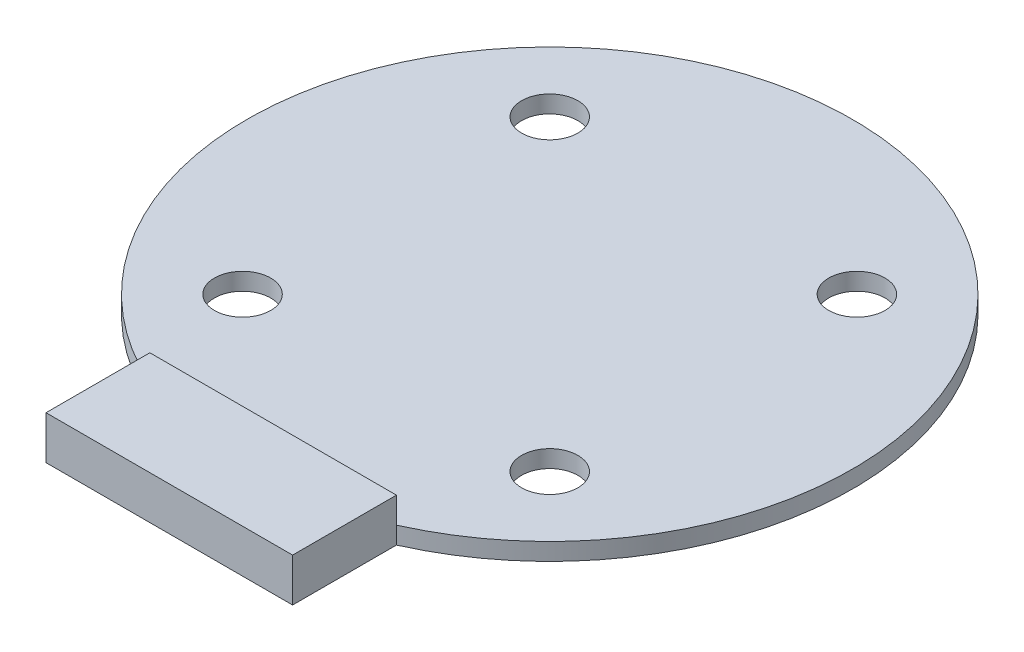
SolidWorks part; units mm, degrees
ref_plane "Front Plane" through (0, 0, 0) normal (0, 0, 1) x (1, 0, 0)
ref_plane "Top Plane" through (0, 0, 0) normal (0, 1, 0) x (1, 0, 0)
ref_plane "Right Plane" through (0, 0, 0) normal (1, 0, 0) x (0, 0, -1)
sketch "Sketch1" plane through (0, 0, 0) normal (0, 1, 0) x (1, 0, 0)
  circle A0 centre (0, 0) radius 35
  dimension "D1" = 70
extrude "Boss-Extrude1" add sketch "Sketch1" along normal blind 2
sketch "Sketch2" plane through (0, 2, 0) normal (0, 1, 0) x (1, 0, 0)
  circle A0 centre (-17.75, 17.75) radius 3.25
  circle A1 centre (17.75, 17.75) radius 3.25
  circle A2 centre (17.75, -17.75) radius 3.25
  circle A3 centre (-17.75, -17.75) radius 3.25
  dimension "D1" = 6.5
  dimension "D2" = 35.5
  dimension "D3" = 17.75
  dimension "D4" = 35.5
  dimension "D5" = 17.75
  dimension "D6" = 35.5
  dimension "D7" = 17.75
  dimension "D8" = 35.5
  dimension "D9" = 17.75
sketch "Sketch4" plane through (0, 2, 0) normal (0, 1, 0) x (1, 0, 0)
  line L0 (-25.4755, -24) -> (25.4755, -24)
  arc A0 (-25.4755, -24) -> (25.4755, -24) centre (0, 0) ccw
  dimension "D1" = 24
extrude "Cut-Extrude3" cut sketch "Sketch4" against normal blind 10
extrude "Cut-Extrude4" cut sketch "Sketch2" against normal through all
sketch "Sketch5" plane through (0, 0, 24) normal (0, 0, 1) x (1, 0, 0)
  line L0 (-50, 0) -> (50, 0)
  line L1 (50, 0) -> (50, 24)
  line L2 (50, 24) -> (-50, 24)
  line L3 (-50, 24) -> (-50, 0)
  dimension "D1" = 24
  dimension "D2" = 100
  dimension "D3" = 50
extrude "Boss-Extrude2" add sketch "Sketch5" along normal blind 120
sketch "Sketch7" plane through (0, 0, 144) normal (0, 0, 1) x (1, 0, 0)
  line L0 (50, 24) -> (-50, 24) construction
  line L1 (-50, 0) -> (50, 0) construction
  arc A0 (-45, 24) -> (45, 24) centre (0, 89.3214) ccw
  point P3 (0, 10)
  dimension "D3" = 10
  dimension "D1" = 90
  dimension "D2" = 45
extrude "Cut-Extrude6" cut sketch "Sketch7" against normal through all and the other way through all
sketch "Sketch9" plane through (0, 24, 0) normal (0, 1, 0) x (1, 0, 0)
  line L0 (-25.4755, -24) -> (25.4755, -24)
  arc A0 (-25.4755, -24) -> (25.4755, -24) centre (0, 0) ccw
extrude "Cut-Extrude7" cut sketch "Sketch9" against normal blind 22
sketch "Sketch11" plane through (0, 24, 0) normal (0, 1, 0) x (1, 0, 0)
  line L0 (0, -35) -> (-25.4755, -35)
  line L2 (-25.4755, -24) -> (-25.4755, -35)
  line L3 (-25.4755, -24) -> (25.4755, -24)
  line L4 (25.4755, -24) -> (25.4755, -35)
  line L6 (25.4755, -35) -> (0, -35)
  arc A0 (-25.4755, -24) -> (25.4755, -24) centre (0, 0) ccw construction
extrude "Cut-Extrude9" cut sketch "Sketch11" against normal blind 14
fillet "Fillet4" radius 20 4 edges at (25.4755, 14.2023, 29.5) (12.9099, 11.0576, 35) (-25.4755, 14.2023, 29.5) (-12.9099, 11.0576, 35)
fillet "Fillet6" radius 20 1 edges at (0, 10, 144)
fillet "Fillet7" radius 5 4 edges at (50, 1.7517, 144) (-50, 1.7517, 144) (50, 18.095, 139.7727) (-50, 13.5033, 142.1035)
ref_plane "Plane1" through (0, 0, 100) normal (0, 0, 1) x (1, 0, 0)
ref_plane "Plane2" through (0, 0, 70) normal (0, 0, 1) x (1, 0, 0)
ref_plane "Plane3" through (0, 0, 24) normal (0, 0, -1) x (-1, 0, 0)
sketch "Sketch13" plane through (0, 0, 0) normal (0, -1, 0) x (1, 0, 0)
  line L0 (25.4755, 24) -> (64.1196, 24)
  line L1 (-50, 24) -> (-25.4755, 24)
  line L2 (-50, 24) -> (-50, 151.5829)
  line L3 (-50, 151.5829) -> (64.1196, 151.5829)
  line L4 (64.1196, 24) -> (64.1196, 151.5829)
  arc A0 (25.4755, 24) -> (-25.4755, 24) centre (0, 0) ccw
extrude "Cut-Extrude10" cut sketch "Sketch13" against normal blind 30
sketch "Sketch14" plane through (0, 2, 0) normal (0, 1, 0) x (1, 0, 0)
  line L0 (-14.25, -31.9678) -> (14.25, -31.9678)
  line L1 (14.25, -31.9678) -> (14.25, -43.9678)
  line L2 (14.25, -43.9678) -> (-14.25, -43.9678)
  line L3 (-14.25, -43.9678) -> (-14.25, -31.9678)
  circle A1 centre (0, 0) radius 35 construction
  dimension "D1" = 12
  dimension "D2" = 28.5
extrude "Boss-Extrude3" add sketch "Sketch14" along normal blind 3
sketch "Sketch15" plane through (0, 2, 0) normal (0, -1, 0) x (1, 0, 0)
  line L1 (-14.25, 43.9678) -> (14.25, 43.9678)
  line L2 (-14.25, 43.9678) -> (-14.25, 31.9678)
  line L4 (14.25, 43.9678) -> (14.25, 31.9678)
  arc A0 (14.25, 31.9678) -> (-14.25, 31.9678) centre (0, 0) ccw
extrude "Boss-Extrude4" add sketch "Sketch15" along normal blind 2
